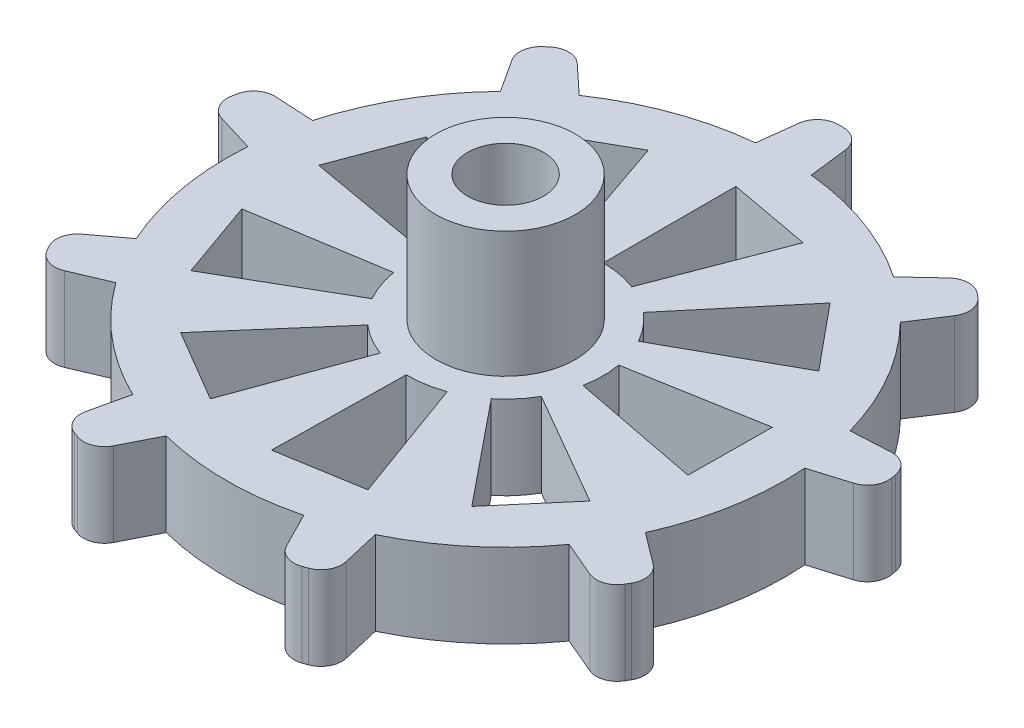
SolidWorks part; units mm, degrees
ref_plane "Plano frontal" through (0, 0, 0) normal (0, 0, 1) x (1, 0, 0)
ref_plane "Plano superior" through (0, 0, 0) normal (0, 1, 0) x (1, 0, 0)
ref_plane "Plano direito" through (0, 0, 0) normal (1, 0, 0) x (0, 0, -1)
sketch "Esboço1" plane through (0, 0, 0) normal (0, 1, 0) x (1, 0, 0)
  line L0 (-6.5221, 8.5943) -> (-6.5221, 18.0943)
  line L1 (-6.5221, 18.0943) -> (-0.6221, 17.0034)
  line L2 (-0.6221, 17.0034) -> (-4.0191, 8.1315)
  line L3 (-2.0226, 6.9566) -> (4.0839, 14.234)
  line L4 (7.9023, 9.6059) -> (-0.4026, 4.9931)
  line L5 (4.0839, 14.234) -> (7.9023, 9.6059)
  line L6 (0.3716, 2.8098) -> (9.7272, 4.4595)
  line L7 (9.6774, -1.5403) -> (0.3504, 0.2645)
  line L8 (9.7272, 4.4595) -> (9.6774, -1.5403)
  line L9 (-0.4599, -1.9057) -> (7.7673, -6.6557)
  line L10 (3.8726, -11.2198) -> (-2.1122, -3.842)
  line L11 (7.7673, -6.6557) -> (3.8726, -11.2198)
  line L12 (-4.1279, -4.9836) -> (-0.8787, -13.9106)
  line L13 (-6.796, -14.9034) -> (-6.6383, -5.4047)
  line L14 (-0.8787, -13.9106) -> (-6.796, -14.9034)
  line L15 (-8.9162, -4.9836) -> (-12.1654, -13.9106)
  line L16 (-17.3365, -10.8676) -> (-11.11, -3.6926)
  line L17 (-12.1654, -13.9106) -> (-17.3365, -10.8676)
  line L18 (-12.5843, -1.9057) -> (-20.8115, -6.6557)
  line L19 (-22.8167, -1.0007) -> (-13.435, 0.4934)
  line L20 (-20.8115, -6.6557) -> (-22.8167, -1.0007)
  line L21 (-13.4157, 2.8098) -> (-22.7714, 4.4595)
  line L22 (-20.6726, 10.0804) -> (-12.5253, 5.1945)
  line L23 (-22.7714, 4.4595) -> (-20.6726, 10.0804)
  line L24 (-11.0216, 6.9566) -> (-17.1281, 14.234)
  line L25 (-11.9072, 17.1908) -> (-8.8067, 8.211)
  line L26 (-17.1281, 14.234) -> (-11.9072, 17.1908)
  line L27 (-8.0221, 25.5943) -> (-5.0221, 25.5943)
  line L28 (-4.5343, 21.5943) -> (-4.5221, 21.5943)
  line L29 (-8.5099, 21.5943) -> (-8.5221, 21.5943)
  line L30 (-6.5221, 25.5943) -> (-5.0221, 25.5943)
  line L31 (-6.5221, 25.5943) -> (-8.0221, 25.5943)
  line L32 (-8.0221, 25.5943) -> (-8.5221, 21.494)
  line L33 (-5.0221, 25.5943) -> (-4.5221, 21.494)
  line L36 (7.7558, 20.9435) -> (4.7371, 18.124)
  line L37 (10.0539, 19.0152) -> (7.8013, 15.5528)
  line L38 (7.7558, 20.9435) -> (10.0539, 19.0152)
  line L40 (16.8528, 7.2391) -> (12.728, 7.0195)
  line L41 (17.3738, 4.2846) -> (13.4226, 3.0802)
  line L42 (16.8528, 7.2391) -> (17.3738, 4.2846)
  line L44 (15.0125, -9.1067) -> (11.7116, -6.6235)
  line L45 (13.5125, -11.7048) -> (9.7116, -10.0876)
  line L46 (15.0125, -9.1067) -> (13.5125, -11.7048)
  line L48 (3.0959, -20.4453) -> (2.1634, -16.4213)
  line L49 (0.2769, -21.4714) -> (-1.5954, -17.7894)
  line L50 (3.0959, -20.4453) -> (0.2769, -21.4714)
  line L52 (-13.321, -21.4714) -> (-11.4488, -17.7894)
  line L53 (-16.1401, -20.4453) -> (-15.2076, -16.4213)
  line L54 (-13.321, -21.4714) -> (-16.1401, -20.4453)
  line L56 (-26.5567, -11.7048) -> (-22.7558, -10.0876)
  line L57 (-28.0567, -9.1067) -> (-24.7558, -6.6235)
  line L58 (-26.5567, -11.7048) -> (-28.0567, -9.1067)
  line L60 (-30.4179, 4.2846) -> (-26.4668, 3.0802)
  line L61 (-29.897, 7.2391) -> (-25.7722, 7.0195)
  line L62 (-30.4179, 4.2846) -> (-29.897, 7.2391)
  line L64 (-23.0981, 19.0152) -> (-20.8455, 15.5528)
  line L65 (-20.7999, 20.9435) -> (-17.7813, 18.124)
  line L66 (-23.0981, 19.0152) -> (-20.7999, 20.9435)
  arc A0 (-8.5221, 21.494) -> (-17.7813, 18.124) centre (-6.5221, 1.5943) ccw
  circle A1 centre (-6.5221, 1.5943) radius 2.75
  arc A2 (-4.0191, 8.1315) -> (-6.5221, 8.5943) centre (-6.5221, 1.5943) ccw
  arc A3 (-0.4026, 4.9931) -> (-2.0226, 6.9566) centre (-6.5221, 1.5943) ccw
  arc A4 (0.3504, 0.2645) -> (0.3716, 2.8098) centre (-6.5221, 1.5943) ccw
  arc A5 (-2.1122, -3.842) -> (-0.4599, -1.9057) centre (-6.5221, 1.5943) ccw
  arc A6 (-6.6383, -5.4047) -> (-4.1279, -4.9836) centre (-6.5221, 1.5943) ccw
  arc A7 (-11.11, -3.6926) -> (-8.9162, -4.9836) centre (-6.5221, 1.5943) ccw
  arc A8 (-13.435, 0.4934) -> (-12.5843, -1.9057) centre (-6.5221, 1.5943) ccw
  arc A9 (-12.5253, 5.1945) -> (-13.4157, 2.8098) centre (-6.5221, 1.5943) ccw
  arc A10 (-8.8067, 8.211) -> (-11.0216, 6.9566) centre (-6.5221, 1.5943) ccw
  arc A11 (-20.8455, 15.5528) -> (-25.7722, 7.0195) centre (-6.5221, 1.5943) ccw
  arc A12 (-26.4668, 3.0802) -> (-24.7558, -6.6235) centre (-6.5221, 1.5943) ccw
  arc A13 (-22.7558, -10.0876) -> (-15.2076, -16.4213) centre (-6.5221, 1.5943) ccw
  arc A14 (-11.4488, -17.7894) -> (-1.5954, -17.7894) centre (-6.5221, 1.5943) ccw
  arc A15 (2.1634, -16.4213) -> (9.7116, -10.0876) centre (-6.5221, 1.5943) ccw
  arc A16 (11.7116, -6.6235) -> (13.4226, 3.0802) centre (-6.5221, 1.5943) ccw
  arc A17 (12.728, 7.0195) -> (7.8013, 15.5528) centre (-6.5221, 1.5943) ccw
  arc A18 (4.7371, 18.124) -> (-4.5221, 21.494) centre (-6.5221, 1.5943) ccw
  point P43 (-6.5221, 1.5943)
  point P85 (-6.5221, 1.5943)
  dimension "D1" = 40
  dimension "D2" = 5.5
  dimension "D3" = 14
  dimension "D4" = 9
  dimension "D6" = 9
  dimension "D5" = 6
  dimension "D9" = 1.5
  dimension "D10" = 1.5
extrude "Ressalto-extrusão1" add sketch "Esboço1" along normal blind 6 contours L36 A18 L33 L27 L32 A0 L65 L66 L64 A11 L61 L62 L60 A12 L57 L58 L56 A13 L53 L54 L52 A14 L49 L50 L48 A15 L45 L46 L44 A16 L41 L42 L40 A17 L37 L38 L25 A10 L24 L26 L19 A8 L18 L20 L13
sketch "Esboço2" plane through (0, 6, 0) normal (0, 1, 0) x (1, 0, 0)
  circle A0 centre (-6.5221, 1.5943) radius 5
  circle A1 centre (-6.5221, 1.5943) radius 2.7226
  dimension "D1" = 10
extrude "Ressalto-extrusão2" add sketch "Esboço2" along normal blind 9
fillet "Filete1" radius 1.5 1 edges at (-26.5567, 3, 11.7048)
fillet "Filete2" radius 1.5 1 edges at (-28.0567, 3, 9.1067)
fillet "Filete3" radius 1.5 1 edges at (-16.1401, 3, 20.4453)
fillet "Filete4" radius 1.5 1 edges at (-13.321, 3, 21.4714)
fillet "Filete5" radius 1.5 1 edges at (0.2769, 3, 21.4714)
fillet "Filete6" radius 1.5 1 edges at (3.0959, 3, 20.4453)
fillet "Filete7" radius 1.5 1 edges at (13.5125, 3, 11.7048)
fillet "Filete8" radius 1.5 1 edges at (15.0125, 3, 9.1067)
fillet "Filete9" radius 1.5 1 edges at (17.3738, 3, -4.2846)
fillet "Filete10" radius 1.5 1 edges at (16.8528, 3, -7.2391)
fillet "Filete11" radius 1.5 1 edges at (-30.4179, 3, -4.2846)
fillet "Filete12" radius 1.5 1 edges at (10.0539, 3, -19.0152)
fillet "Filete13" radius 1.5 1 edges at (7.7558, 3, -20.9435)
fillet "Filete14" radius 1.5 1 edges at (-5.0221, 3, -25.5943)
fillet "Filete15" radius 1.5 1 edges at (-8.0221, 3, -25.5943)
fillet "Filete16" radius 1.5 1 edges at (-20.7999, 3, -20.9435)
fillet "Filete17" radius 1.5 1 edges at (-23.0981, 3, -19.0152)
fillet "Filete18" radius 1.5 1 edges at (-29.897, 3, -7.2391)
